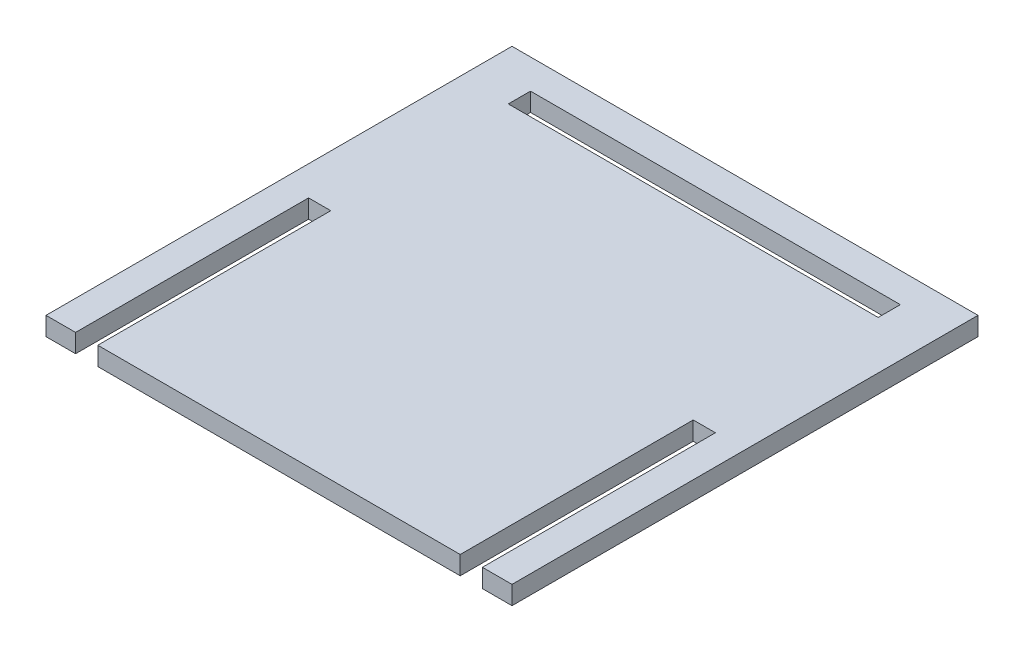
SolidWorks part; units mm, degrees
ref_plane "Front Plane" through (0, 0, 0) normal (0, 0, 1) x (1, 0, 0)
ref_plane "Top Plane" through (0, 0, 0) normal (0, 1, 0) x (1, 0, 0)
ref_plane "Right Plane" through (0, 0, 0) normal (1, 0, 0) x (0, 0, -1)
sketch "Sketch1" plane through (0, 0, 0) normal (0, 1, 0) x (1, 0, 0)
  line L0 (-27.5, -31.5) -> (-27.5, 0)
  line L1 (-31.5, 31.5) -> (31.5, 31.5)
  line L2 (-31.5, 31.5) -> (-31.5, -31.5)
  line L3 (-31.5, -31.5) -> (-27.5, -31.5)
  line L4 (31.5, 31.5) -> (31.5, -31.5)
  line L5 (-31.5, 31.5) -> (31.5, -31.5) construction
  line L6 (-31.5, -31.5) -> (31.5, 31.5) construction
  line L7 (-27.5, 0) -> (-24.5, 0)
  line L8 (-24.5, 0) -> (-24.5, -31.5)
  line L9 (0, 31.5) -> (0, -31.5) construction
  line L10 (27.5, -31.5) -> (27.5, 0)
  line L11 (27.5, 0) -> (24.5, 0)
  line L12 (24.5, 0) -> (24.5, -31.5)
  line L13 (-24.5, -31.5) -> (24.5, -31.5)
  line L14 (27.5, -31.5) -> (31.5, -31.5)
  line L16 (-25, 27.5) -> (25, 27.5)
  line L17 (-25, 27.5) -> (-25, 24.5)
  line L18 (-25, 24.5) -> (25, 24.5)
  line L19 (25, 27.5) -> (25, 24.5)
  line L20 (-25, 27.5) -> (25, 24.5) construction
  line L21 (-25, 24.5) -> (25, 27.5) construction
  point P0 (0, 0)
  point P16 (0, 26)
  dimension "D1" = 63
  dimension "D2" = 63
  dimension "D3" = 3
  dimension "D4" = 4
  dimension "D5" = 4
  dimension "D6" = 3
  dimension "D7" = 6.5
extrude "Boss-Extrude1" add sketch "Sketch1" along normal blind 2.5
